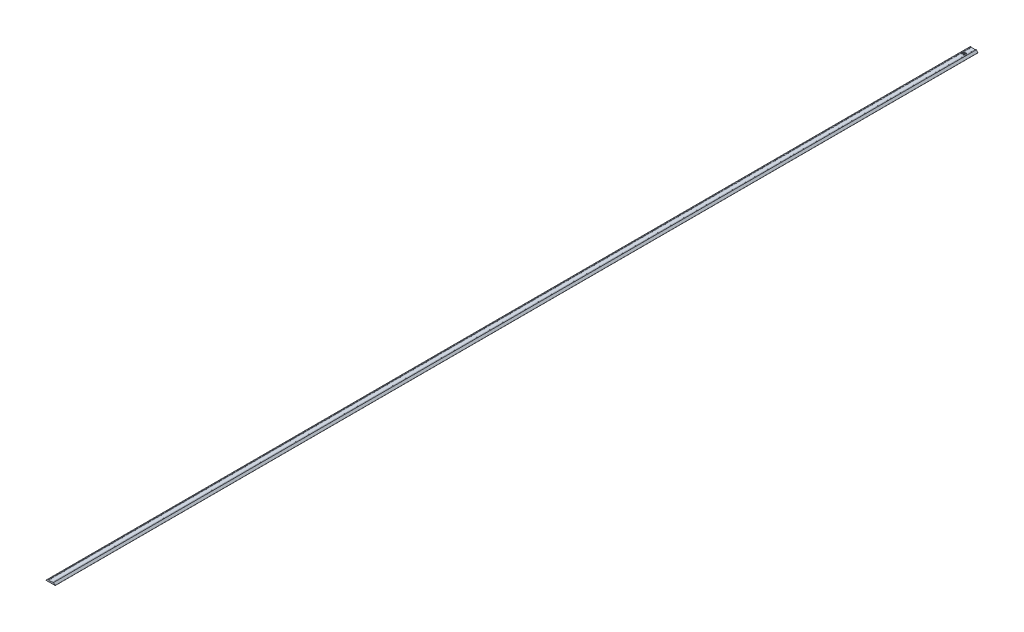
SolidWorks part; units mm, degrees
ref_plane "Front Plane" through (0, 0, 0) normal (0, 0, 1) x (1, 0, 0)
ref_plane "Top Plane" through (0, 0, 0) normal (0, 1, 0) x (1, 0, 0)
ref_plane "Right Plane" through (0, 0, 0) normal (1, 0, 0) x (0, 0, -1)
sketch "Sketch1" plane through (0, 0, 0) normal (0, 0, 1) x (1, 0, 0)
  line L0 (0.1, 0) -> (3, 0)
  line L1 (0, 0.1) -> (0, 0.2586)
  line L2 (0.0293, 0.3293) -> (3.6707, 3.9707)
  line L3 (3.7414, 4) -> (5.35, 4)
  line L4 (5.5, 3.85) -> (5.5, 3.75)
  line L5 (5.35, 3.6) -> (5.025, 3.6)
  line L6 (4.875, 3.45) -> (4.875, 3.4)
  line L7 (5.025, 3.25) -> (6, 3.25)
  line L8 (15.125, 3.4) -> (15.125, 3.45)
  line L9 (14.975, 3.6) -> (14.65, 3.6)
  line L10 (14.5, 3.75) -> (14.5, 3.85)
  line L11 (14.65, 4) -> (16.2586, 4)
  line L12 (16.3293, 3.9707) -> (19.9707, 0.3293)
  line L13 (20, 0.2586) -> (20, 0.1)
  line L14 (19.9, 0) -> (17, 0)
  line L15 (17, 0) -> (17, 0.05)
  line L16 (17, 0.05) -> (3, 0.05)
  line L17 (3, 0.05) -> (3, 0)
  line L18 (14, 3.25) -> (14.975, 3.25)
  line L19 (0, 0) -> (0.801, 0) construction
  line L20 (6, 3.25) -> (6, 3.2)
  line L21 (6, 3.2) -> (9.9, 3.2)
  line L22 (14, 3.25) -> (14, 3.2)
  line L23 (0, 0) -> (0, 0.3) construction
  line L24 (9.9, 3.2) -> (14, 3.2)
  line L25 (0, 0.3) -> (0.2634, 0.5634) construction
  arc A0 (5.025, 3.6) -> (4.875, 3.45) centre (5.025, 3.45) ccw
  arc A1 (5.025, 3.25) -> (4.875, 3.4) centre (5.025, 3.4) cw
  arc A2 (5.5, 3.75) -> (5.35, 3.6) centre (5.35, 3.75) cw
  arc A3 (5.35, 4) -> (5.5, 3.85) centre (5.35, 3.85) cw
  arc A4 (15.125, 3.4) -> (14.975, 3.25) centre (14.975, 3.4) cw
  arc A5 (14.975, 3.6) -> (15.125, 3.45) centre (14.975, 3.45) cw
  arc A6 (14.5, 3.75) -> (14.65, 3.6) centre (14.65, 3.75) ccw
  arc A7 (14.65, 4) -> (14.5, 3.85) centre (14.65, 3.85) ccw
  arc A8 (20, 0.1) -> (19.9, 0) centre (19.9, 0.1) cw
  arc A9 (19.9707, 0.3293) -> (20, 0.2586) centre (19.9, 0.2586) cw
  arc A10 (16.3293, 3.9707) -> (16.2586, 4) centre (16.2586, 3.9) ccw
  arc A11 (3.6707, 3.9707) -> (3.7414, 4) centre (3.7414, 3.9) cw
  arc A12 (0.0293, 0.3293) -> (0, 0.2586) centre (0.1, 0.2586) ccw
  arc A13 (0.1, 0) -> (0, 0.1) centre (0.1, 0.1) cw
  point P42 (20, 0)
  point P45 (20, 0.3)
  point P52 (0, 0.3)
  point P55 (0, 0)
  dimension "D17" = 0.15
  dimension "D19" = 3.2
  dimension "D24" = 0.1
  dimension "D1" = 20
  dimension "D2" = 3
  dimension "D3" = 3
  dimension "D4" = 0.3
  dimension "D5" = 0.3
  dimension "D6" = 0.05
  dimension "D7" = 4
  dimension "D8" = 4
  dimension "D9" = 10.25
  dimension "D10" = 4.875
  dimension "D11" = 0.75
  dimension "D12" = 0.35
  dimension "D13" = 0.35
  dimension "D14" = 9
  dimension "D15" = 0.625
  dimension "D16" = 135
  dimension "D18" = 4.875
  dimension "D20" = 0.625
  dimension "D21" = 8
  dimension "D22" = 6
  dimension "D23" = 0.05
extrude "Extrude1" add sketch "Sketch1" along normal blind 2000
hole_wizard "CBORE for M3 Hex Socket Head Cap Screw1" positions "Sketch5" profile "Sketch4" counterbore size "M3" standard "DIN"
sketch "Sketch5" plane through (0, 3.2, 0) normal (0, 1, 0) x (-1, 0, 0)
  line L0 (-14, 0) -> (-6, 0) construction
  line L1 (0, 2000) -> (0, 0) construction
  point P0 (-10, 20)
  dimension "D1" = 20
  dimension "D2" = 10
sketch "Sketch4" plane through (10, 3.2, 20) normal (1, 0, 0) x (0, 0, 1)
  line L0 (0, 0) -> (0, 3.2)
  line L1 (0, 3.2) -> (1.7, 3.2)
  line L3 (1.7, 3.2) -> (1.7, 1.5)
  line L4 (1.7, 1.5) -> (3.75, 1.5)
  line L5 (3.75, 1.5) -> (3.75, 0)
  line L7 (3.75, 0) -> (0, 0)
  line L11 (0, -6.35) -> (0, 107.95) construction
  dimension "Thru Hole Dia." = 3.4
  dimension "Thru Hole Depth" = 3.2
  dimension "C'Bore Dia." = 7.5
  dimension "C'Bore Depth" = 1.5
